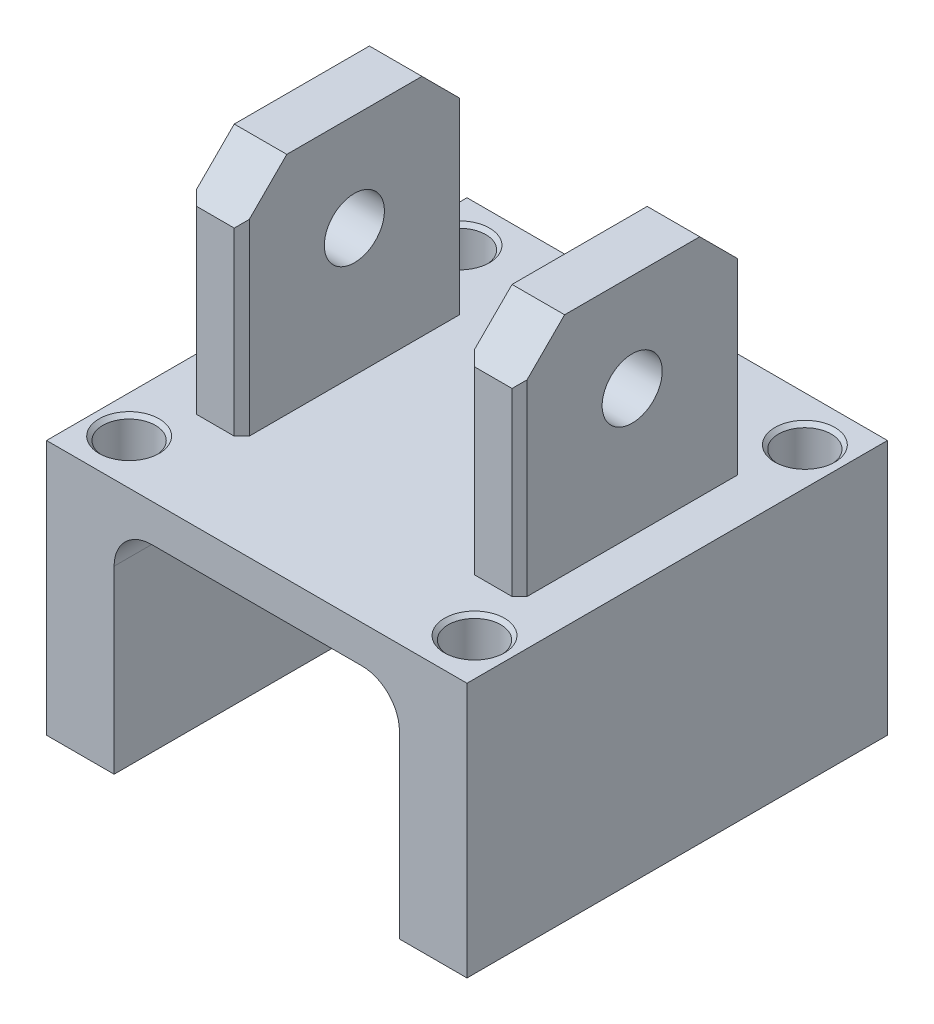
SolidWorks part; units mm, degrees
ref_plane "Спереди" through (0, 0, 0) normal (0, 0, 1) x (1, 0, 0)
ref_plane "Сверху" through (0, 0, 0) normal (0, 1, 0) x (1, 0, 0)
ref_plane "Справа" through (0, 0, 0) normal (1, 0, 0) x (0, 0, -1)
sketch "Эскиз1" plane through (0, 0, 0) normal (0, 1, 0) x (1, 0, 0)
  line L1 (-28, 28) -> (28, 28)
  line L2 (-28, 28) -> (-28, -28)
  line L3 (-28, -28) -> (28, -28)
  line L4 (28, 28) -> (28, -28)
  line L5 (-28, 28) -> (28, -28) construction
  line L6 (-28, -28) -> (28, 28) construction
  point P0 (0, 0)
  dimension "D1" = 56
  dimension "D2" = 56
extrude "Бобышка-Вытянуть1" add sketch "Эскиз1" along normal blind 34
sketch "Эскиз2" plane through (0, 0, 0) normal (0, 0, 1) x (1, 0, 0)
  line L0 (-28, 0) -> (28, 0) construction
  line L1 (-19, 0) -> (19, 0)
  line L2 (-19, 0) -> (-19, 24)
  line L3 (-14, 29) -> (14, 29)
  line L4 (19, 0) -> (19, 24)
  line L5 (-28, 34) -> (28, 34) construction
  arc A0 (19, 24) -> (14, 29) centre (14, 24) ccw
  arc A1 (-19, 24) -> (-14, 29) centre (-14, 24) cw
  point P12 (19, 29)
  point P15 (-19, 29)
  dimension "D4" = 5
  dimension "D1" = 38
  dimension "D2" = 19
  dimension "D3" = 5
extrude "Вырез-Вытянуть1" cut sketch "Эскиз2" against normal through all both and the other way through all
sketch "Эскиз3" plane through (0, 34, 0) normal (0, 1, 0) x (1, 0, 0)
  line L0 (28, 28) -> (-28, 28) construction
  line L1 (-22, 15) -> (-15, 15)
  line L2 (-22, 15) -> (-22, -15)
  line L3 (-22, -15) -> (-15, -15)
  line L4 (-15, 15) -> (-15, -15)
  line L5 (-28, 28) -> (-28, -28) construction
  line L6 (0, 0) -> (0, 28) construction
  line L7 (15, 15) -> (15, -15)
  line L8 (22, -15) -> (15, -15)
  line L9 (22, 15) -> (22, -15)
  line L10 (22, 15) -> (15, 15)
  dimension "D1" = 30
  dimension "D2" = 7
  dimension "D3" = 13
  dimension "D4" = 6
  dimension "D5" = 30
extrude "Бобышка-Вытянуть2" add sketch "Эскиз3" along normal blind 30
chamfer "Chanfrein1" distance 6 angle 45 4 edges at (18.5, 64, -15) (18.5, 64, 15) (-18.5, 64, -15) (-18.5, 64, 15)
chamfer "Фаска1" distance 1 angle 45 8 edges at (-22, 46, -15) (-15, 46, -15) (15, 46, -15) (22, 46, -15) (22, 46, 15) (15, 46, 15) (-15, 46, 15) (-22, 46, 15)
sketch "Эскиз4" plane through (22, 0, 0) normal (1, 0, 0) x (0, 0, -1)
  line L1 (15, 58) -> (15, 34) construction
  line L2 (-14, 34) -> (14, 34) construction
  circle A0 centre (0, 51) radius 4
  dimension "D1" = 17
  dimension "D2" = 15
  dimension "D3" = 8
extrude "Вырез-Вытянуть2" cut sketch "Эскиз4" against normal up to surface (44 mm away)
sketch "Эскиз7" plane through (0, 0, 0) normal (0, -1, 0) x (1, 0, 0)
  line L0 (1.4122, 0) -> (29.4122, 0) construction
  line L2 (0, 0) -> (0, 17.631) construction
  circle A0 centre (-23, 22) radius 2.5
  circle A1 centre (-23, -22) radius 2.5
  circle A2 centre (23, -22) radius 2.5
  circle A3 centre (23, 22) radius 2.5
  dimension "D1" = 5
  dimension "D2" = 22
  dimension "D3" = 23
extrude "Вырез-Вытянуть7" cut sketch "Эскиз7" against normal blind 10
sketch "Эскиз8" plane through (0, 34, 0) normal (0, 1, 0) x (1, 0, 0)
  circle A0 centre (-23, 22) radius 3.5
  circle A1 centre (-23, -22) radius 3.5
  circle A2 centre (23, 22) radius 3.5
  circle A3 centre (23, -22) radius 3.5
extrude "Вырез-Вытянуть8" cut sketch "Эскиз8" against normal blind 15
chamfer "Фаска2" distance 0.5 angle 45 8 edges at (-23, 0, 19.5) (23, 0, 24.5) (23, 0, -24.5) (-23, 0, -19.5) (-23, 34, 25.5) (23, 34, 25.5) (-23, 34, -18.5) (23, 34, -18.5)
sketch "Эскиз9" plane through (0, 34, 0) normal (0, 1, 0) x (1, 0, 0)
  point P0 (-5.7441, 21.005)
  point P1 (3.9559, 21.005)
hole_wizard "Цековка для  болта с шестигранной головкой M51" positions "Эскиз10" profile "Эскиз11" counterbore size "M5" standard "Ansi Metric"
sketch "Эскиз10" plane through (0, 34, 0) normal (0, 1, 0) x (-1, 0, 0)
  point P0 (5.7441, -21.005)
  point P3 (-3.9559, -21.005)
sketch "Эскиз11" plane through (-5.7441, 34, -21.005) normal (1, 0, 0) x (0, 0, 1)
  line L0 (0, 0) -> (0, 34)
  line L1 (0, 34) -> (1.6, 34)
  line L3 (1.6, 34) -> (1.6, 4)
  line L4 (1.6, 4) -> (3, 4)
  line L5 (3, 4) -> (3, 0)
  line L7 (3, 0) -> (0, 0)
  line L11 (0, -6.35) -> (0, 107.95) construction
  dimension "Диаметр сквозного отверстия" = 3.2
  dimension "Глубина сквозного отверстия" = 34
  dimension "Диаметр цековки" = 6
  dimension "Глубина цековки" = 4
